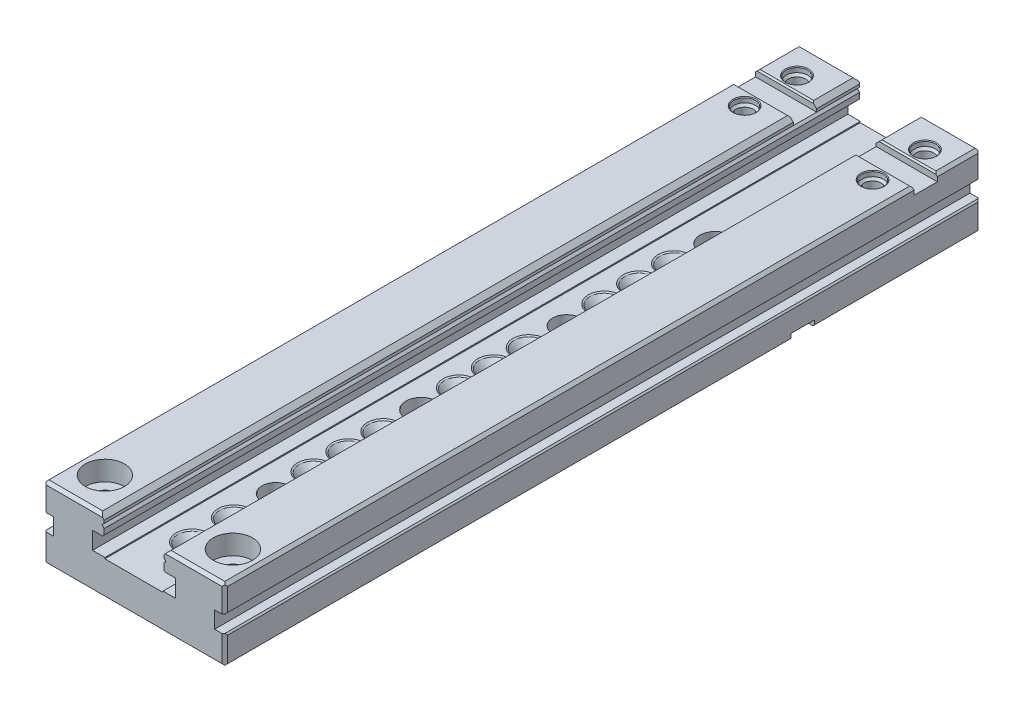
SolidWorks part; units mm, degrees
ref_plane "Front Plane" through (0, 0, 0) normal (0, 0, 1) x (1, 0, 0)
ref_plane "Top Plane" through (0, 0, 0) normal (0, 1, 0) x (1, 0, 0)
ref_plane "Right Plane" through (0, 0, 0) normal (1, 0, 0) x (0, 0, -1)
imported_body "Imported1"
sketch "Sketch1" plane through (0, 24.2, 0) normal (0, 1, 0) x (1, 0, 0)
  circle A0 centre (0, 397.5) radius 12.4968
  circle A1 centre (0, 297.5) radius 11
  circle A2 centre (0, 197.5) radius 11
extrude "Boss-Extrude1" add sketch "Sketch1" against normal up to surface (18.2 mm away)
sketch "Sketch2" plane through (0, 24.2, 0) normal (0, 1, 0) x (1, 0, 0)
  circle A0 centre (0, 97.5) radius 12.4968
extrude "Boss-Extrude2" add sketch "Sketch2" against normal up to surface (24.2 mm away)
hole_wizard "Hole1" positions "Sketch4" profile "Sketch3" legacy
sketch "Sketch4" plane through (0, 24.2, 0) normal (0, 1, 0) x (1, 0, 0)
  line L1 (-60.5, 520) -> (-21.5, 520) construction
  point P0 (2.3085, 397.5)
  point P8 (0, 197.5)
  dimension "D1" = 122.5
  dimension "D2" = 200
sketch "Sketch3" plane through (2.3085, 24.2, -397.5) normal (1, 0, 0) x (0, 0, 1)
  line L0 (0, 0) -> (0, 100)
  line L1 (0, 100) -> (8, 100)
  line L2 (8, 100) -> (8, 8)
  line L3 (8, 8) -> (10.5, 8)
  line L4 (10.5, 8) -> (10.5, 0)
  line L5 (10.5, 0) -> (0, 0)
  line L6 (0, 110) -> (0, -10) construction
  dimension "Diameter" = 16
  dimension "Depth" = 100
  dimension "C-Bore Diameter" = 21
  dimension "C-Bore Depth" = 8
hole_wizard "Hole2" positions "Sketch6" profile "Sketch5" legacy
sketch "Sketch6" plane through (0, 24.2, 0) normal (0, 1, 0) x (1, 0, 0)
  circle A0 centre (2.3085, 397.5) radius 10.5 construction
  point P0 (0, 297.5)
  point P2 (0, 97.5)
  dimension "D1" = 100
  dimension "D2" = 200
sketch "Sketch5" plane through (0, 24.2, -297.5) normal (1, 0, 0) x (0, 0, 1)
  line L0 (0, 0) -> (0, 100)
  line L1 (0, 100) -> (6.5, 100)
  line L2 (6.5, 100) -> (6.5, 12.5)
  line L3 (6.5, 12.5) -> (9.5, 12.5)
  line L4 (9.5, 12.5) -> (9.5, 0)
  line L5 (9.5, 0) -> (0, 0)
  line L6 (0, 110) -> (0, -10) construction
  dimension "Diameter" = 13
  dimension "Depth" = 100
  dimension "C-Bore Diameter" = 19
  dimension "C-Bore Depth" = 12.5
